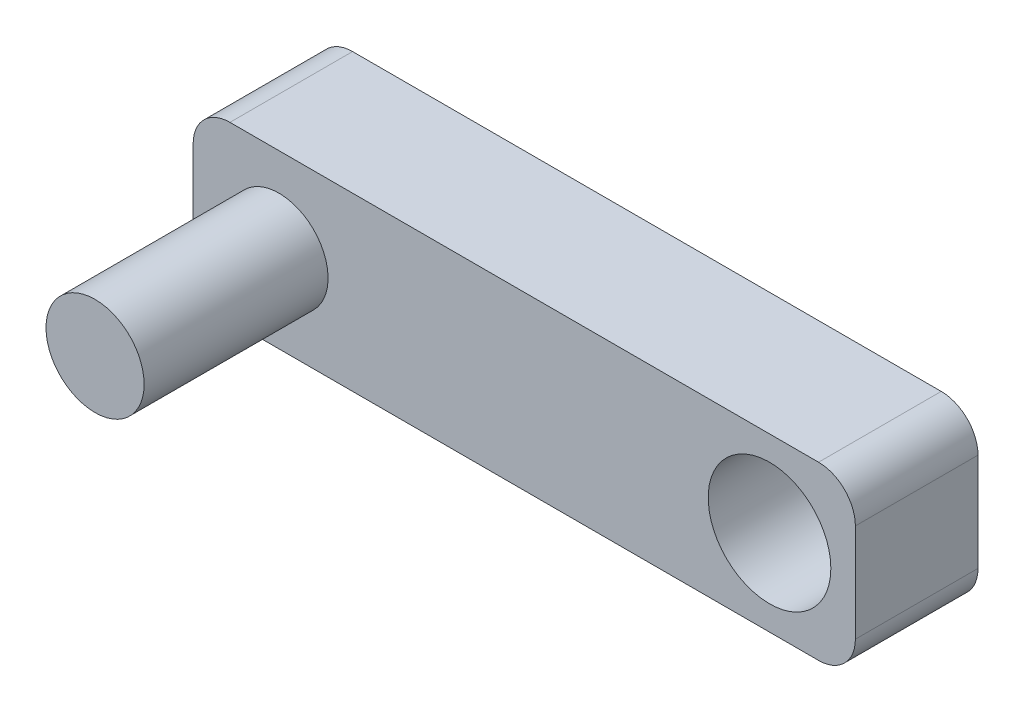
SolidWorks part; units mm, degrees
ref_plane "正面" through (0, 0, 0) normal (0, 0, 1) x (1, 0, 0)
ref_plane "平面" through (0, 0, 0) normal (0, 1, 0) x (1, 0, 0)
ref_plane "右側面" through (0, 0, 0) normal (1, 0, 0) x (0, 0, -1)
sketch "ｽｹｯﾁ1" plane through (0, 0, 0) normal (0, 0, 1) x (1, 0, 0)
  line L1 (0, 0) -> (540, 0)
  line L2 (0, 0) -> (0, 140)
  line L3 (0, 140) -> (540, 140)
  line L4 (540, 0) -> (540, 140)
  dimension "D1" = 540
  dimension "D2" = 140
extrude "押し出し1" add sketch "ｽｹｯﾁ1" along normal blind 100
sketch "ｽｹｯﾁ2" plane through (0, 0, 100) normal (0, 0, 1) x (1, 0, 0)
  line L0 (540, 0) -> (540, 140) construction
  line L1 (0, 0) -> (540, 0) construction
  circle A0 centre (470, 70) radius 50
  dimension "D1" = 100
  dimension "D2" = 70
  dimension "D3" = 70
extrude "押し出し2" cut sketch "ｽｹｯﾁ2" against normal through all
sketch "ｽｹｯﾁ3" plane through (0, 0, 100) normal (0, 0, 1) x (1, 0, 0)
  line L0 (0, 140) -> (0, 0) construction
  line L1 (0, 0) -> (540, 0) construction
  circle A0 centre (70, 70) radius 40
  dimension "D1" = 80
  dimension "D2" = 70
  dimension "D3" = 70
extrude "押し出し3" add sketch "ｽｹｯﾁ3" along normal blind 150
fillet "ﾌｨﾚｯﾄ1" radius 30 4 edges at (540, 0, 50) (540, 140, 50) (0, 0, 50) (0, 140, 50)
